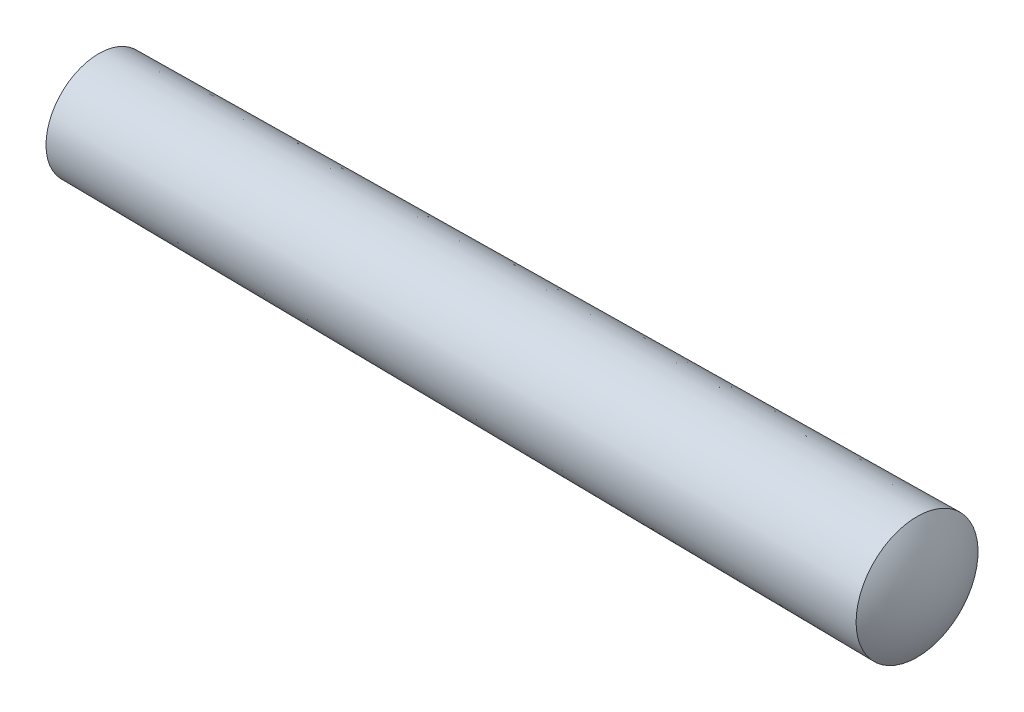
SolidWorks part; units mm, degrees
ref_plane "Plane1" through (0, 0, 0) normal (0, 0, 1) x (1, 0, 0)
ref_plane "Plane2" through (0, 0, 0) normal (0, 1, 0) x (1, 0, 0)
ref_plane "Plane3" through (0, 0, 0) normal (1, 0, 0) x (0, 0, -1)
sketch "BodySke" plane through (0, 0, 0) normal (0, 0, 1) x (1, 0, 0)
  line L0 (-0.6699, 0) -> (210, 0) construction
  line L1 (60, 0) -> (-0.6699, 0) construction
  line L2 (0, 2.5) -> (38.74, 2.8874)
  line L3 (0, 0) -> (0, 10) construction
  line L4 (-0.6699, 0) -> (39.658, 0)
  arc A0 (0, 2.5) -> (-0.6699, 0) centre (4.3301, 0) ccw
  arc A1 (38.74, 2.8874) -> (39.658, 0) centre (34.658, 0) cw
  dimension "D3" = 5
  dimension "D1" = 5
  dimension "Diameter" = 5
  dimension "D2" = 0.573
  dimension "Length" = 38.74
revolve "Body" add sketch "BodySke" angle 360 about L0
equation "\"D1@BodySke\" = \"Diameter@BodySke\""
equation "\"D3@BodySke\" = \"Diameter@BodySke\""
